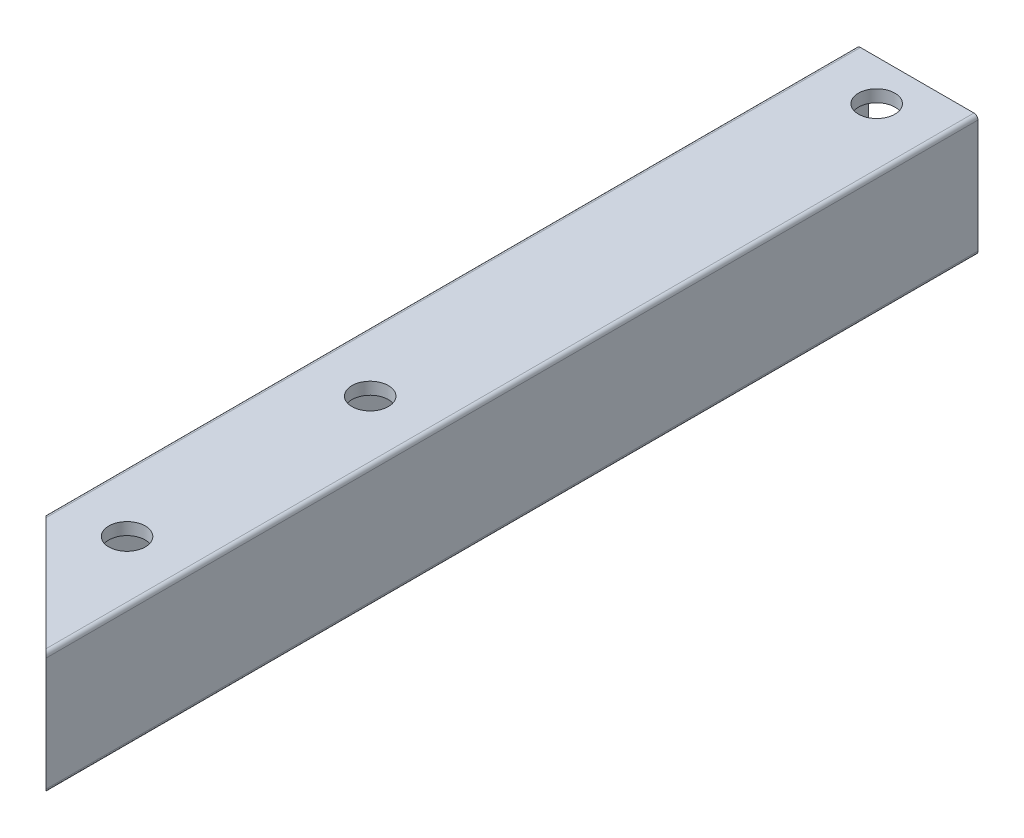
SolidWorks part; units mm, degrees
ref_plane "Plan1" through (0, 0, 0) normal (0, 0, 1) x (1, 0, 0)
ref_plane "Plan2" through (0, 0, 0) normal (0, 1, 0) x (1, 0, 0)
ref_plane "Plan3" through (0, 0, 0) normal (1, 0, 0) x (0, 0, -1)
sketch "Esquisse1" plane through (0, 0, 0) normal (0, 0, 1) x (1, 0, 0)
  line L0 (-14, 15) -> (14, 15)
  line L1 (-15, 14) -> (-15, -14)
  line L2 (14, -15) -> (-14, -15)
  line L3 (15, -14) -> (15, 14)
  line L4 (14, 14) -> (-14, -14) construction
  arc A0 (-14, -15) -> (-15, -14) centre (-14, -14) cw
  arc A1 (-15, 14) -> (-14, 15) centre (-14, 14) cw
  arc A2 (15, 14) -> (14, 15) centre (14, 14) ccw
  arc A3 (15, -14) -> (14, -15) centre (14, -14) cw
  dimension "D1" = 1
  dimension "D2" = 30
extrude "Base-Extru.-Mince" add sketch "Esquisse1" along normal blind 230 thin
sketch "Esquisse2" plane through (0, -15, 0) normal (0, -1, 0) x (1, 0, 0)
  line L0 (17.5, 232.5) -> (-49.9462, 165.0538)
  line L1 (14, 230) -> (-14, 230) construction
  line L2 (14, 0) -> (-14, 0) construction
  circle A0 centre (0, 135) radius 4.5
  circle A1 centre (0, 195) radius 4.5
  spline_without_curve S0
  dimension "D2" = 195
  dimension "D4" = 60
  dimension "D3" = 9
  dimension "D1" = 45
extrude "Enlèv. mat.-Extru.1" cut sketch "Esquisse2" against normal through all
sketch "Esquisse4" plane through (0, 15, 0) normal (0, 1, 0) x (-1, 0, 0)
  line L0 (14, 0) -> (-14, 0) construction
  circle A0 centre (0, 10) radius 4.5
  dimension "D1" = 9
  dimension "D2" = 10
extrude "Enlèv. mat.-Extru.2" cut sketch "Esquisse4" against normal through all
sketch "Esquisse5" plane through (0, -15, 0) normal (0, -1, 0) x (1, 0, 0)
  line L0 (-14, 201) -> (14, 229) construction
  point P0 (0, 215)
